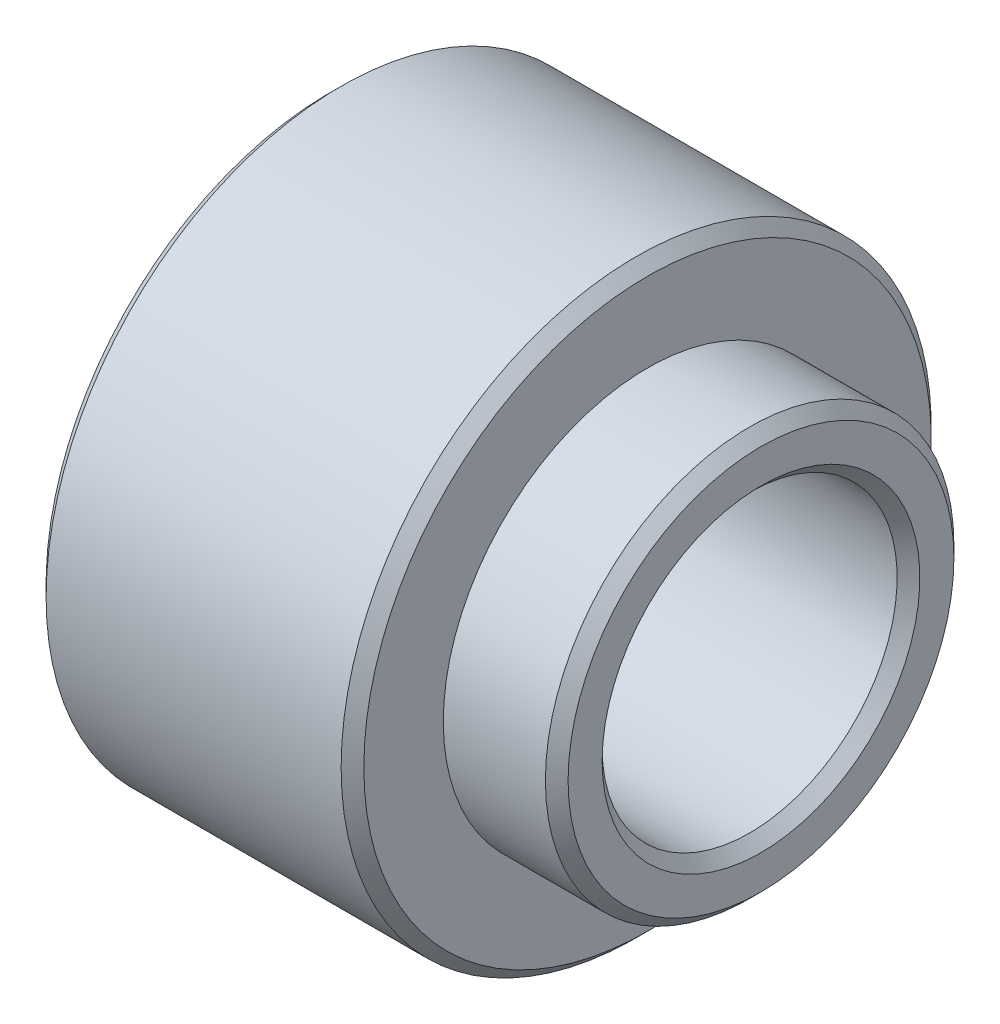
SolidWorks part; units mm, degrees
ref_plane "Front Plane" through (0, 0, 0) normal (0, 0, 1) x (1, 0, 0)
ref_plane "Top Plane" through (0, 0, 0) normal (0, 1, 0) x (1, 0, 0)
ref_plane "Right Plane" through (0, 0, 0) normal (1, 0, 0) x (0, 0, -1)
sketch "Sketch1" plane through (0, 0, 0) normal (0, 0, 1) x (1, 0, 0)
  line L0 (0, 0) -> (27.0079, 0) construction
  line L1 (0, 11) -> (7.7942, 6.5)
  line L2 (7.7942, 6.5) -> (19, 6.5)
  line L3 (19, 6.5) -> (19, 9)
  line L4 (19, 9) -> (14, 9)
  line L5 (14, 9) -> (14, 13)
  line L6 (14, 13) -> (0, 13)
  line L7 (0, 13) -> (0, 11)
  dimension "D1" = 26
  dimension "D2" = 13
  dimension "D3" = 18
  dimension "D4" = 19
  dimension "D5" = 14
  dimension "D6" = 30
  dimension "D7" = 22
revolve "Revolve1" add sketch "Sketch1" angle 360 about L0
chamfer "Chamfer1" distance 0.5 angle 45 4 edges at (14, 0, 13) (19, 0, 9) (0, 0, 13) (19, 0, 6.5)
